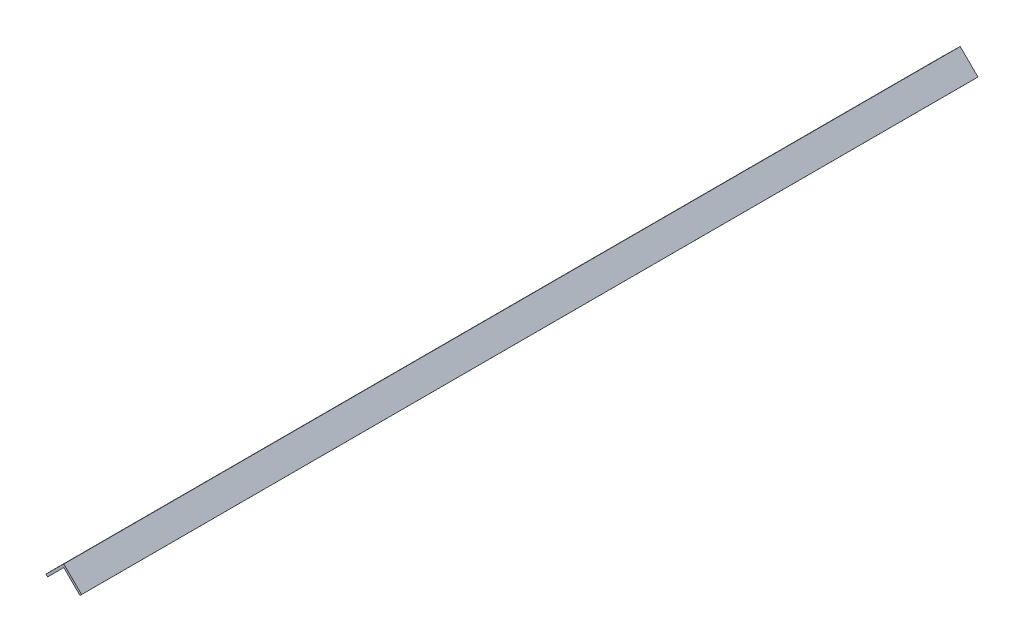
SolidWorks part; units mm, degrees
ref_plane "Front Plane" through (0, 0, 0) normal (0, 0, 1) x (1, 0, 0)
ref_plane "Top Plane" through (0, 0, 0) normal (0, 1, 0) x (1, 0, 0)
ref_plane "Right Plane" through (0, 0, 0) normal (1, 0, 0) x (0, 0, -1)
sketch "Sketch2" plane through (0, 0, 0) normal (0, 0, 1) x (1, 0, 0)
  line L0 (-40.6688, 0) -> (0, 40.6688)
  line L1 (0, 40.6688) -> (40.6688, 0)
  line L2 (0, 40.6688) -> (0, 0)
  line L3 (40.6688, 0) -> (-40.6688, 0) construction
  line L4 (0, 48.4876) -> (44.8796, 4.2742)
  line L5 (-44.8796, 4.2742) -> (0, 48.4876)
  line L6 (-44.8796, 4.2742) -> (-40.6688, 0)
  line L7 (44.8796, 4.2742) -> (40.6688, 0)
  line L8 (44.8796, 4.2742) -> (-44.8796, 4.2742) construction
  dimension "D1" = 90
  dimension "D2" = 6
  dimension "D3" = 63
extrude "Boss-Extrude1" add sketch "Sketch2" along normal blind 2260 contours L0 L6 L5 L4 L7 L1
